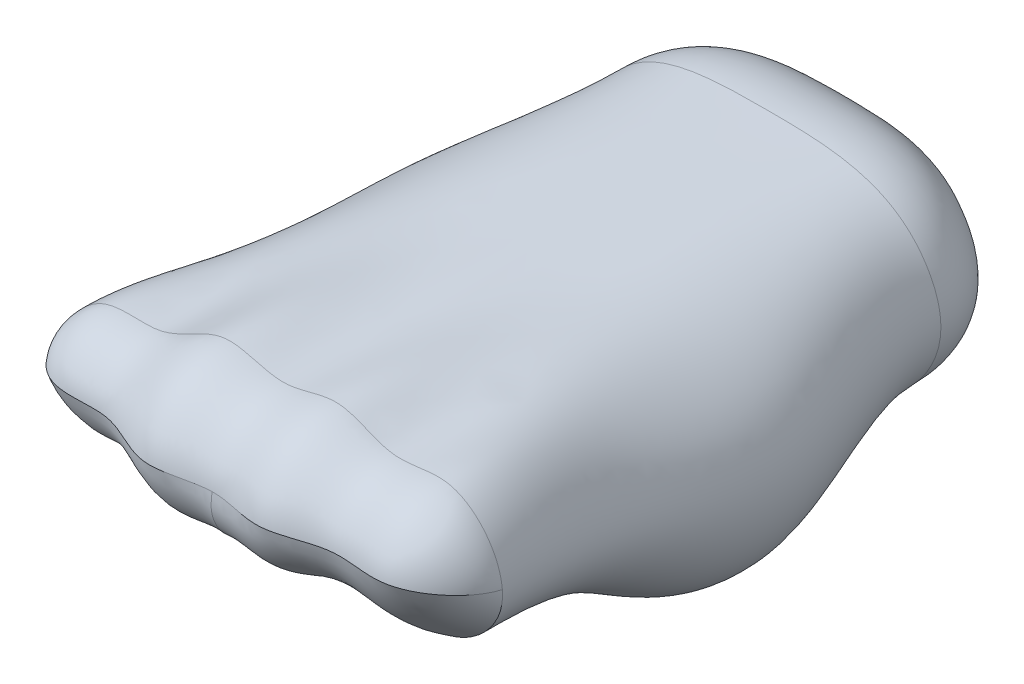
SolidWorks part; units mm, degrees
ref_plane "Front" through (0, 0, 0) normal (0, 0, 1) x (1, 0, 0)
ref_plane "Top" through (0, 0, 0) normal (0, 1, 0) x (1, 0, 0)
ref_plane "Right" through (0, 0, 0) normal (1, 0, 0) x (0, 0, -1)
sketch "Sketch1" plane through (0, 0, 0) normal (0, 0, 1) x (1, 0, 0)
  circle A0 centre (0, 0) radius 0.5
  dimension "D1" = 1
extrude "Base-Extrude" add sketch "Sketch1" along normal mid plane 1
other "Join1"
other "Hands<1>@Hand-"
sketch "Sketch2" plane through (0, 7.9465, 0) normal (0, -1, 0) x (1, 0, 0)
  circle A3 centre (-26.1239, 78.595) radius 5.1
  circle A4 centre (-26.1239, 78.595) radius 5.1
  circle A6 centre (-8.8286, 81.0431) radius 5.1
  circle A7 centre (-8.8286, 81.0431) radius 5.1
  circle A9 centre (8.8286, 81.0431) radius 5.1
  circle A10 centre (8.8286, 81.0431) radius 5.1
  circle A12 centre (26.3358, 78.5495) radius 5.1
  circle A13 centre (26.3358, 78.5495) radius 5.1
  dimension "D1" = 0.1
  dimension "D2" = 0.1
  dimension "D3" = 0.1
  dimension "D4" = 0.1
extrude "Cut-Extrude1" cut sketch "Sketch2" along normal up to surface (3 mm away)
sketch "Sketch3" plane through (7.1426, 0, -0.8833) normal (0.9924, 0, -0.1227) x (-0.1227, 0, -0.9924)
  circle A2 centre (-14.1213, -4.5689) radius 5.1
  circle A3 centre (-14.1213, -4.5689) radius 5.1
  dimension "D1" = 0.1
extrude "Cut-Extrude2" cut sketch "Sketch3" against normal up to surface (1 mm away)
